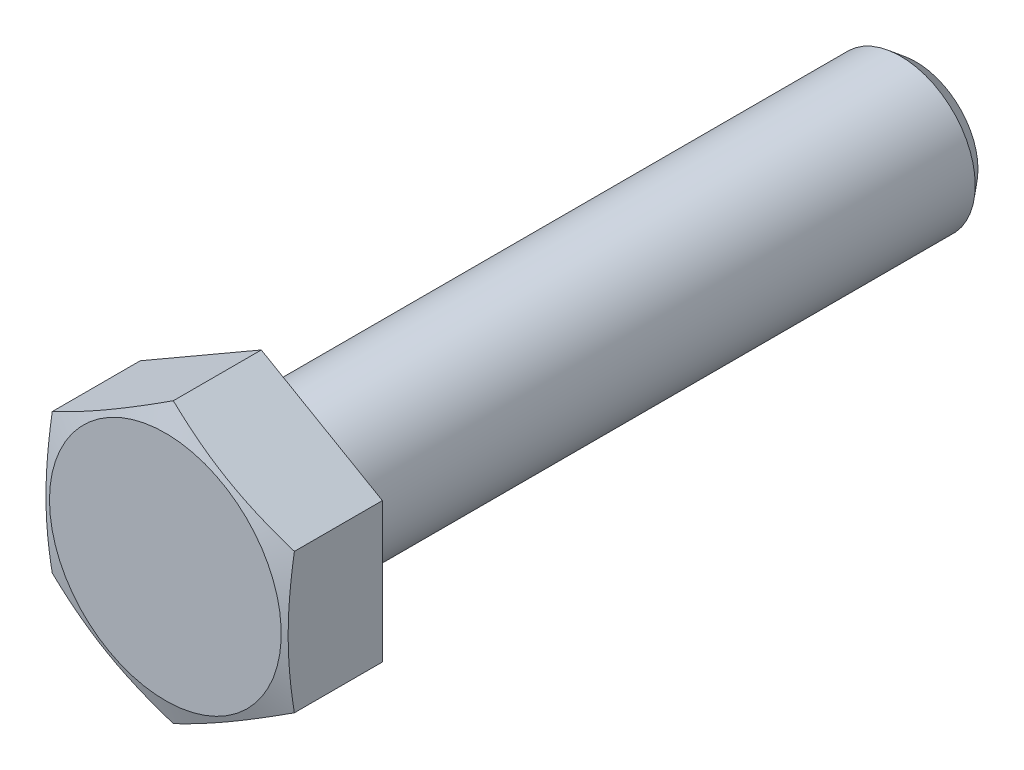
SolidWorks part; units mm, degrees
ref_plane "Plan1" through (0, 0, 0) normal (0, 0, 1) x (1, 0, 0)
ref_plane "Plan2" through (0, 0, 0) normal (0, 1, 0) x (1, 0, 0)
ref_plane "Plan3" through (0, 0, 0) normal (1, 0, 0) x (0, 0, -1)
imported_body "Vis à métaux - Tête hexagonale - tige entièrement filetée DIN 933 - M8x35 - 6,8"
sketch "Esquisse1" plane through (0, 0, -2.544) normal (0, 0, 1) x (1, 0, 0)
  circle A0 centre (0, 0) radius 4 construction
  circle A1 centre (0, 0) radius 4
extrude "Boss.-Extru.1" add sketch "Esquisse1" along normal up to next
